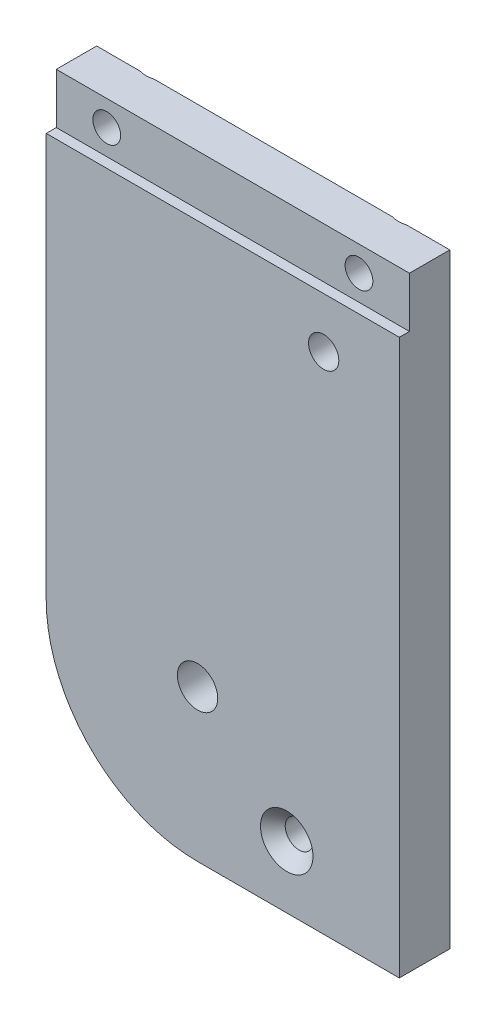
SolidWorks part; units mm, degrees
ref_plane "Plan de face" through (0, 0, 0) normal (0, 0, 1) x (1, 0, 0)
ref_plane "Plan de dessus" through (0, 0, 0) normal (0, 1, 0) x (1, 0, 0)
ref_plane "Plan de droite" through (0, 0, 0) normal (1, 0, 0) x (0, 0, -1)
sketch "Esquisse1" plane through (0, 0, 0) normal (0, 0, 1) x (1, 0, 0)
  line L0 (0, 10) -> (-100, 10) construction
  line L1 (-80, 135) -> (-10, 135)
  line L2 (-80, 135) -> (-80, 45)
  line L3 (-50, 15) -> (-10, 15)
  line L4 (-10, 135) -> (-10, 15)
  circle A0 centre (-50, 45) radius 4 construction
  arc A1 (-80, 45) -> (-50, 15) centre (-50, 45) ccw
  circle A2 centre (-50, 45) radius 4
  dimension "D3" = 40
  dimension "D1" = 120
  dimension "D2" = 5
  dimension "D4" = 70
extrude "Boss.-Extru.1" add sketch "Esquisse1" along normal blind 10
sketch "Esquisse2" plane through (-10, 0, 0) normal (1, 0, 0) x (0, 0, -1)
  line L1 (-10, 135) -> (-8, 135)
  line L2 (-10, 135) -> (-10, 125)
  line L3 (-10, 125) -> (-8, 125)
  line L4 (-8, 135) -> (-8, 125)
  dimension "D1" = 2
  dimension "D2" = 10
extrude "Enlèv. mat.-Extru.1" cut sketch "Esquisse2" against normal through all
sketch "Esquisse3" plane through (0, 0, 10) normal (0, 0, 1) x (1, 0, 0)
  line L0 (-80, 135) -> (-10, 135) construction
  line L1 (-10, 15) -> (-10, 125) construction
  circle A0 centre (-25, 115) radius 3
  dimension "D3" = 6
  dimension "D1" = 20
  dimension "D2" = 15
extrude "Enlèv. mat.-Extru.2" cut sketch "Esquisse3" against normal through all
hole_wizard "Fraisage pour vis à tête fraisée M51" positions "Esquisse6" profile "Esquisse5" countersink size "M5" standard "Ansi Metric"
sketch "Esquisse6" plane through (0, 0, 10) normal (0, 0, 1) x (1, 0, 0)
  arc A0 (-34.0901, 29.0901) -> (-30.5546, 25.5546) centre (-32.3223, 27.3223) ccw construction
  point P0 (-32.3223, 27.3223)
sketch "Esquisse5" plane through (-32.3223, 27.3223, 10) normal (1, 0, 0) x (0, -1, 0)
  line L0 (0, 0) -> (0, 10)
  line L1 (0, 10) -> (2.75, 10)
  line L2 (2.75, 10) -> (2.75, 2.45)
  line L3 (2.75, 2.45) -> (5.2, 0)
  line L5 (5.2, 0) -> (0, 0)
  line L6 (-2.75, 2.45) -> (-5.2, 0) construction
  line L11 (0, -6.35) -> (0, 107.95) construction
  dimension "Diamètre du perçage jusqu'au prochain" = 5.5
  dimension "Profondeur du perçage jusqu'au prochain" = 10
  dimension "Diamètre du fraisage entrant" = 10.4
  dimension "Angle du fraisage entrant" = 90
hole_wizard "Fraisage pour vis à tête fraisée M52" positions "Esquisse9" profile "Esquisse8" countersink size "M5" standard "Ansi Metric"
sketch "Esquisse9" plane through (0, 0, 0) normal (0, 0, -1) x (-1, 0, 0)
  line L0 (10, 15) -> (10, 135) construction
  line L1 (80, 135) -> (80, 45) construction
  line L2 (10, 135) -> (80, 135) construction
  point P0 (20, 130)
  point P2 (70, 130)
  dimension "D1" = 10
  dimension "D2" = 10
  dimension "D3" = 5
  dimension "D4" = 5
sketch "Esquisse8" plane through (-20, 130, 0) normal (1, 0, 0) x (0, 1, 0)
  line L0 (0, 0) -> (0, 10)
  line L1 (0, 10) -> (2.75, 10)
  line L2 (2.75, 10) -> (2.75, 2.45)
  line L3 (2.75, 2.45) -> (5.2, 0)
  line L5 (5.2, 0) -> (0, 0)
  line L6 (-2.75, 2.45) -> (-5.2, 0) construction
  line L11 (0, -6.35) -> (0, 107.95) construction
  dimension "Diamètre du perçage jusqu'au prochain" = 5.5
  dimension "Profondeur du perçage jusqu'au prochain" = 10
  dimension "Diamètre du fraisage entrant" = 10.4
  dimension "Angle du fraisage entrant" = 90
